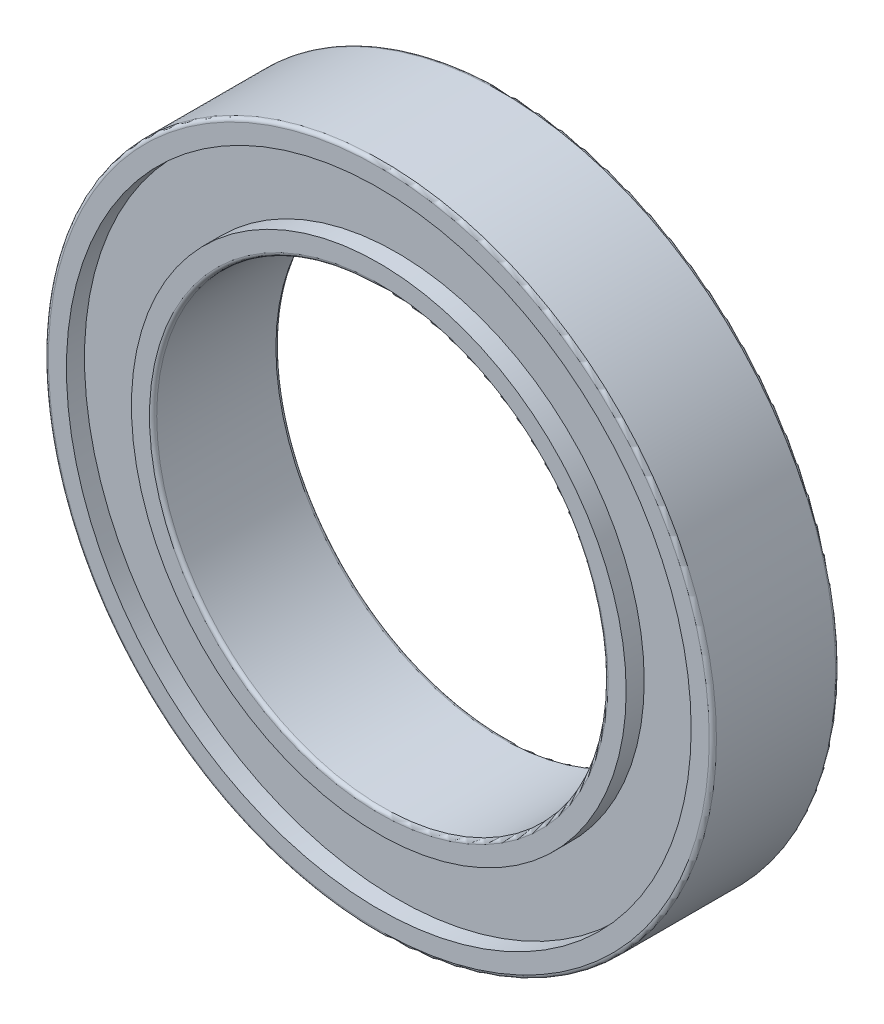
SolidWorks part; units mm, degrees
ref_plane "前视基准面" through (0, 0, 0) normal (0, 0, 1) x (1, 0, 0)
ref_plane "上视基准面" through (0, 0, 0) normal (0, 1, 0) x (1, 0, 0)
ref_plane "右视基准面" through (0, 0, 0) normal (1, 0, 0) x (0, 0, -1)
sketch "草图1" plane through (0, 0, 0) normal (0, 0, 1) x (1, 0, 0)
  circle A0 centre (0, 0) radius 18.5
  circle A1 centre (0, 0) radius 12.5
  dimension "D1" = 25
  dimension "D2" = 37
extrude "凸台-拉伸1" add sketch "草图1" along normal blind 7
sketch "草图2" plane through (0, 0, 7) normal (0, 0, 1) x (1, 0, 0)
  circle A0 centre (0, 0) radius 13.7
  circle A1 centre (0, 0) radius 17.3
  circle A2 centre (0, 0) radius 18.5 construction
  circle A3 centre (0, 0) radius 12.5 construction
  dimension "D1" = 1.2
  dimension "D2" = 1.2
extrude "切除-拉伸1" cut sketch "草图2" against normal blind 1
sketch "草图3" plane through (0, 0, 0) normal (0, 0, -1) x (-1, 0, 0)
  circle A0 centre (0, 0) radius 13.7
  circle A1 centre (0, 0) radius 17.3
  circle A2 centre (0, 0) radius 18.5 construction
  circle A3 centre (0, 0) radius 12.5 construction
  dimension "D1" = 1.2
  dimension "D2" = 1.2
extrude "切除-拉伸2" cut sketch "草图3" against normal blind 1
fillet "圆角1" radius 0.2 4 edges at (12.5, 0, 7) (12.5, 0, 0) (18.5, 0, 0) (18.5, 0, 7)
